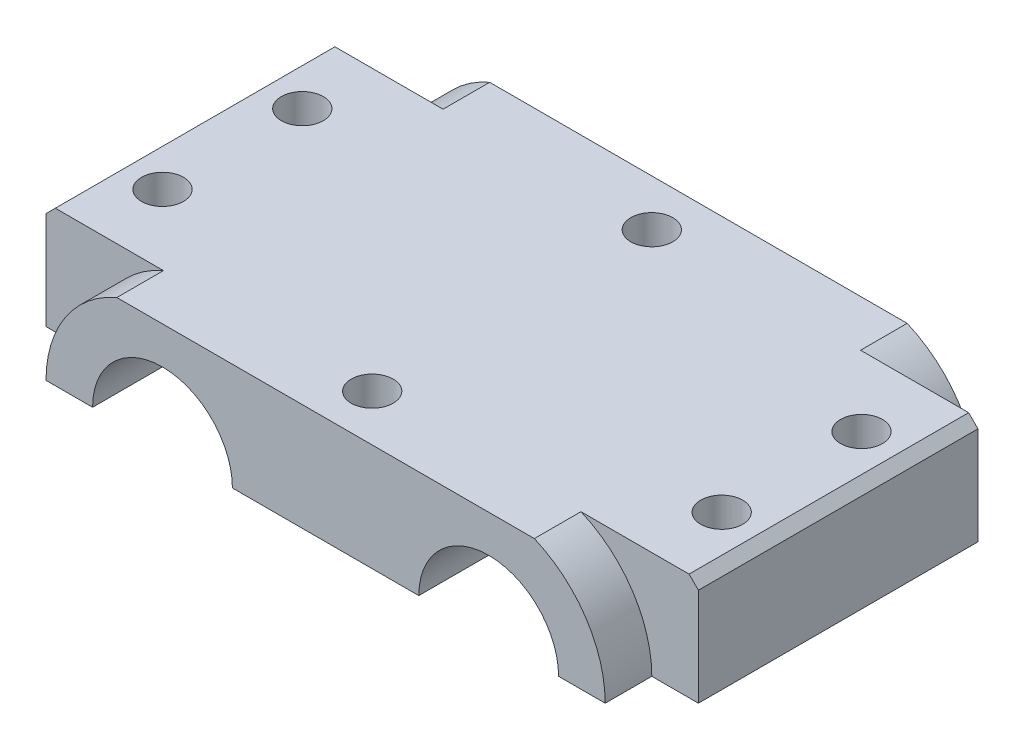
SolidWorks part; units mm, degrees
ref_plane "Front Plane" through (0, 0, 0) normal (0, 0, 1) x (1, 0, 0)
ref_plane "Top Plane" through (0, 0, 0) normal (0, 1, 0) x (1, 0, 0)
ref_plane "Right Plane" through (0, 0, 0) normal (1, 0, 0) x (0, 0, -1)
sketch "Sketch1" plane through (0, 0, 0) normal (0, 1, 0) x (1, 0, 0)
  line L1 (-35, -15) -> (35, -15)
  line L2 (-35, -15) -> (-35, 15)
  line L3 (-35, 15) -> (35, 15)
  line L4 (35, -15) -> (35, 15)
  line L5 (-35, -15) -> (35, 15) construction
  line L6 (-35, 15) -> (35, -15) construction
  point P0 (0, 0)
  dimension "D1" = 30
  dimension "D2" = 70
extrude "Boss-Extrude1" add sketch "Sketch1" along normal blind 11.5
sketch "Sketch2" plane through (0, 11.5, 0) normal (0, 1, 0) x (1, 0, 0)
  line L0 (-35, -15) -> (35, -15) construction
  line L1 (-35, 15) -> (-35, -15) construction
  line L2 (35, 15) -> (-35, 15) construction
  line L3 (35, -15) -> (35, 15) construction
  circle A0 centre (-30, 7.5) radius 2.25
  circle A1 centre (-30, -7.5) radius 2.25
  circle A4 centre (30, 7.5) radius 2.25
  circle A5 centre (30, -7.5) radius 2.25
  dimension "D1" = 4.5
  dimension "D2" = 15
  dimension "D3" = 7.5
  dimension "D4" = 5
  dimension "D5" = 15
  dimension "D6" = 7.5
  dimension "D7" = 5
extrude "Cut-Extrude1" cut sketch "Sketch2" against normal through all
sketch "Sketch3" plane through (0, 0, 15) normal (0, 0, 1) x (1, 0, 0)
  line L0 (-35, 0) -> (35, 0) construction
  line L1 (-35, 11.5) -> (-35, 0) construction
  line L2 (-30, 0) -> (-25, 0)
  line L3 (-22.399, 11.5) -> (22.399, 11.5)
  line L4 (-10, 0) -> (10, 0)
  line L5 (25, 0) -> (30, 0)
  arc A0 (-10, 0) -> (-25, 0) centre (-17.5, 0) ccw
  arc A1 (25, 0) -> (10, 0) centre (17.5, 0) ccw
  arc A2 (-22.399, 11.5) -> (-30, 0) centre (-17.5, 0) ccw
  arc A3 (30, 0) -> (22.399, 11.5) centre (17.5, 0) ccw
  dimension "D1" = 15
  dimension "D4" = 25
  dimension "D5" = 25
  dimension "D2" = 35
  dimension "D3" = 17.5
extrude "Boss-Extrude2" add sketch "Sketch3" along normal blind 5
sketch "Sketch4" plane through (0, 0, 20) normal (0, 0, 1) x (1, 0, 0)
  line L0 (-25, 0) -> (-10, 0) construction
  line L1 (10, 0) -> (25, 0) construction
  circle A0 centre (-17.5, 0) radius 7.5
  circle A1 centre (17.5, 0) radius 7.5
extrude "Cut-Extrude2" cut sketch "Sketch4" against normal blind 67
mirror "Mirror1" about plane through (0, 0, 0) normal (0, 0, 1) of "Boss-Extrude2"
chamfer "Chamfer1" distance 1 angle 45 2 edges at (-35, 11.5, 0) (35, 11.5, 0)
sketch "Sketch5" plane through (0, 11.5, 0) normal (0, 1, 0) x (1, 0, 0)
  line L0 (22.399, 20) -> (-22.399, 20) construction
  line L1 (22.399, -20) -> (-22.399, -20) construction
  circle A0 centre (0, 15) radius 2.25
  circle A1 centre (0, -15) radius 2.25
  dimension "D1" = 4.5
  dimension "D2" = 5
  dimension "D3" = 5
extrude "Cut-Extrude3" cut sketch "Sketch5" against normal through all
